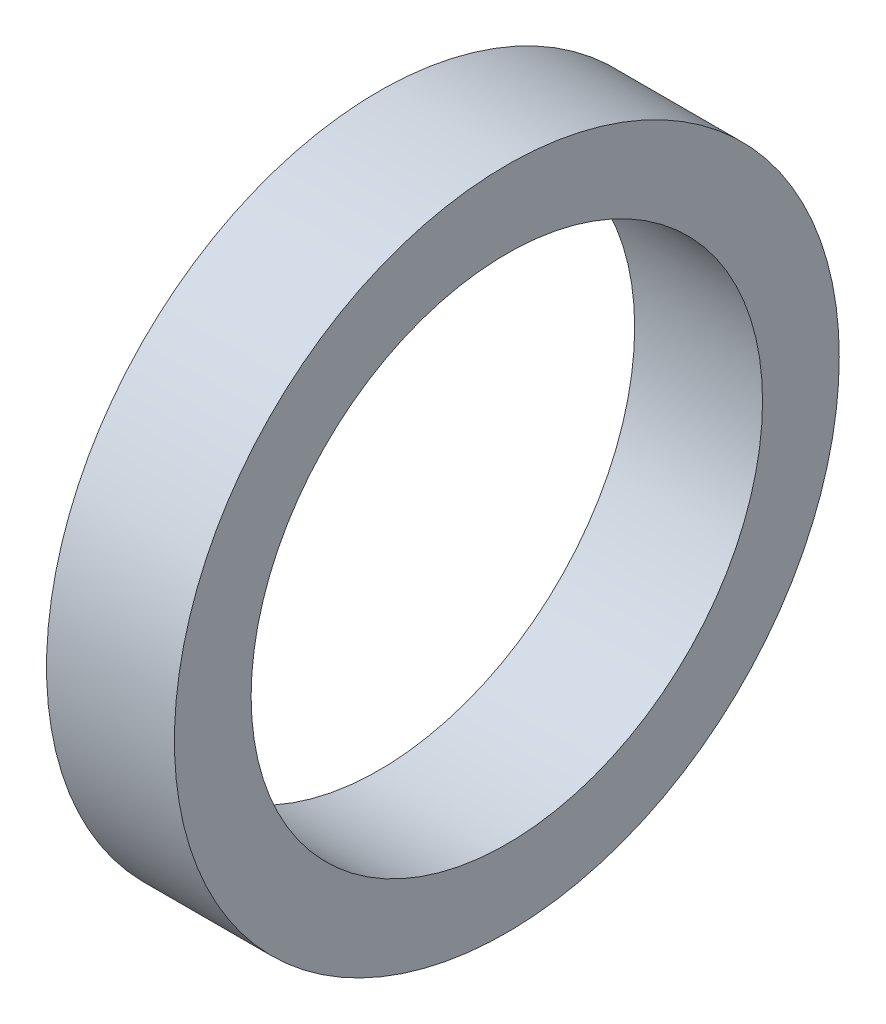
SolidWorks part; units mm, degrees
ref_plane "Plan1" through (0, 0, 0) normal (0, 0, 1) x (1, 0, 0)
ref_plane "Plan2" through (0, 0, 0) normal (0, 1, 0) x (1, 0, 0)
ref_plane "Plan3" through (0, 0, 0) normal (1, 0, 0) x (0, 0, -1)
sketch "Esquisse1" plane through (0, 0, 0) normal (1, 0, 0) x (0, 0, -1)
  circle A0 centre (0, 0) radius 10
  circle A1 centre (0, 0) radius 13
  dimension "D1" = 20
  dimension "D2" = 26
extrude "BASE" add sketch "Esquisse1" against normal blind 5
